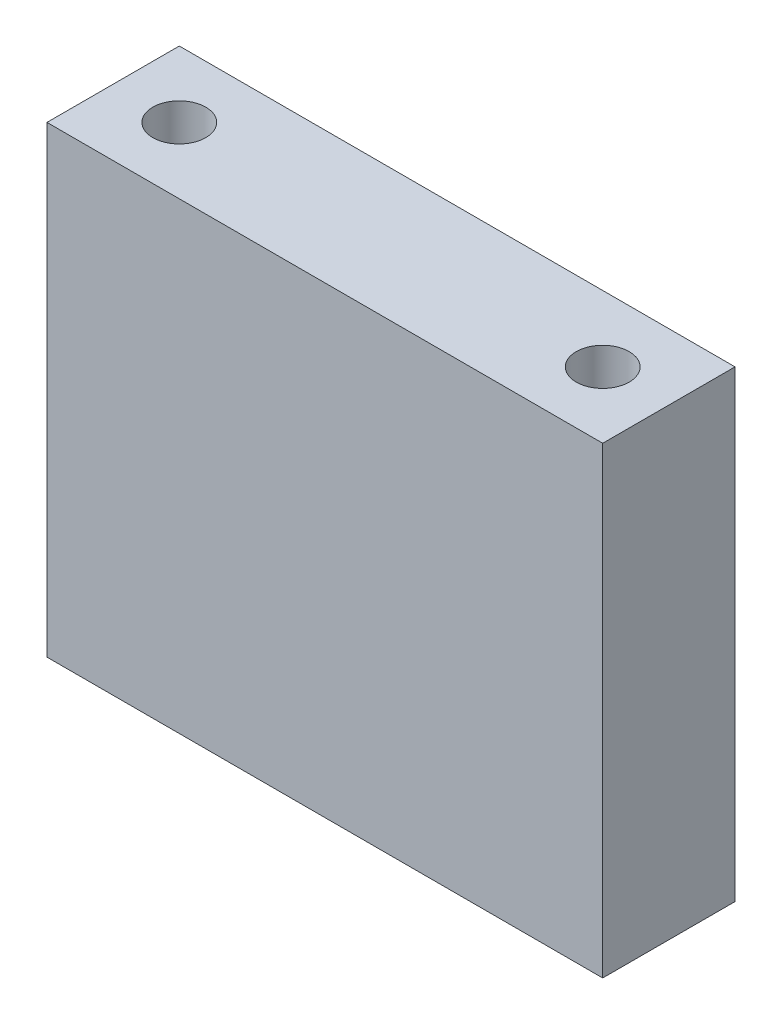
SolidWorks part; units mm, degrees
ref_plane "Front Plane" through (0, 0, 0) normal (0, 0, 1) x (1, 0, 0)
ref_plane "Top Plane" through (0, 0, 0) normal (0, 1, 0) x (1, 0, 0)
ref_plane "Right Plane" through (0, 0, 0) normal (1, 0, 0) x (0, 0, -1)
sketch "Sketch1" plane through (0, 0, 0) normal (0, 1, 0) x (1, 0, 0)
  line L1 (42, -10) -> (-42, -10)
  line L2 (42, -10) -> (42, 10)
  line L3 (42, 10) -> (-42, 10)
  line L4 (-42, -10) -> (-42, 10)
  line L5 (42, -10) -> (-42, 10) construction
  line L6 (42, 10) -> (-42, -10) construction
  circle A0 centre (-32, 0) radius 4
  circle A1 centre (32, 0) radius 4
  point P0 (0, 0)
  point P6 (-32, 0)
  point P7 (32, 0)
  point P8 (42, 0)
  dimension "D5" = 8
  dimension "D6" = 8
  dimension "D1" = 20
  dimension "D2" = 84
  dimension "D3" = 10
  dimension "D4" = 10
extrude "Boss-Extrude1" add sketch "Sketch1" along normal blind 70
